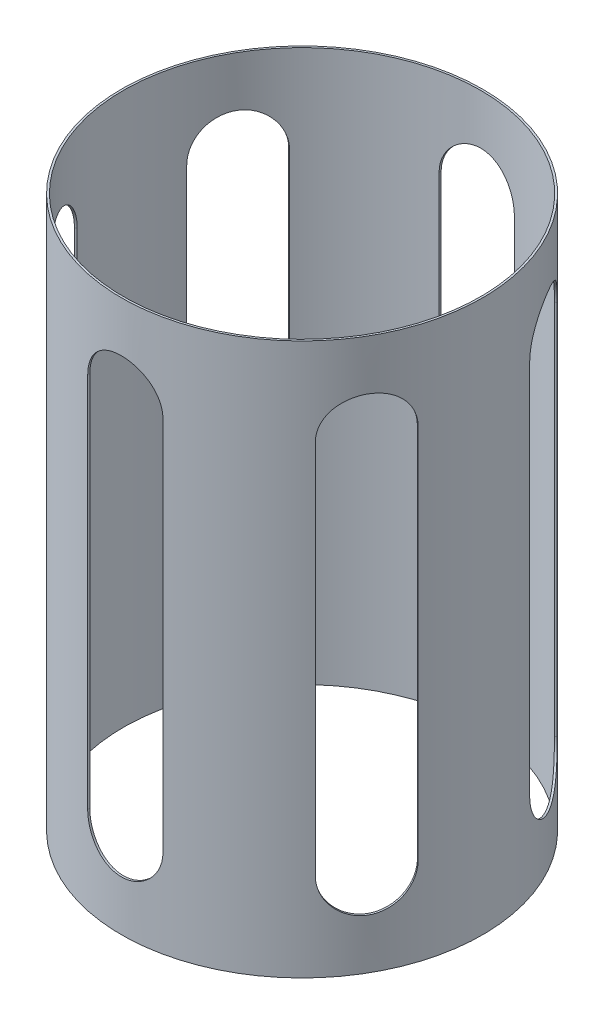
SolidWorks part; units mm, degrees
ref_plane "Front Plane" through (0, 0, 0) normal (0, 0, 1) x (1, 0, 0)
ref_plane "Top Plane" through (0, 0, 0) normal (0, 1, 0) x (1, 0, 0)
ref_plane "Right Plane" through (0, 0, 0) normal (1, 0, 0) x (0, 0, -1)
sketch "Sketch1" plane through (0, 0, 0) normal (0, 0, 1) x (1, 0, 0)
  line L0 (0, 0) -> (0, 471.2833) construction
  line L1 (-85.725, 23.2156) -> (-85.725, 21.2344) construction
  line L2 (-90.4875, 0) -> (-91.5111, 0)
  line L3 (-90.4875, 0) -> (-90.4875, 279.4)
  line L4 (-90.4875, 279.4) -> (-91.5111, 279.4)
  line L5 (-91.5111, 0) -> (-91.5111, 279.4)
  dimension "D1" = 1.0236
  dimension "D2" = 279.4
  dimension "D3" = 4.7625
revolve "Revolve1" add sketch "Sketch1" angle 360 about L0
sketch "Sketch2" plane through (0, 0, 0) normal (0, 0, 1) x (1, 0, 0)
  line L0 (0, 234.95) -> (0, 44.45) construction
  line L1 (19.05, 234.95) -> (19.05, 44.45)
  line L2 (-19.05, 234.95) -> (-19.05, 44.45)
  line L3 (91.5111, 279.4) -> (-91.5111, 279.4) construction
  line L5 (-91.5111, 0) -> (91.5111, 0) construction
  arc A0 (19.05, 234.95) -> (-19.05, 234.95) centre (0, 234.95) ccw
  arc A1 (-19.05, 44.45) -> (19.05, 44.45) centre (0, 44.45) ccw
  point P3 (0, 139.7)
  dimension "D1" = 25.4
  dimension "D2" = 25.4
  dimension "D3" = 38.1
extrude "Cut-Extrude1" cut sketch "Sketch2" against normal through all
pattern_circular "CirPattern1" count 6 over 360 about axis through (0, 0, 0) along (0, 1, 0) of "Cut-Extrude1"
